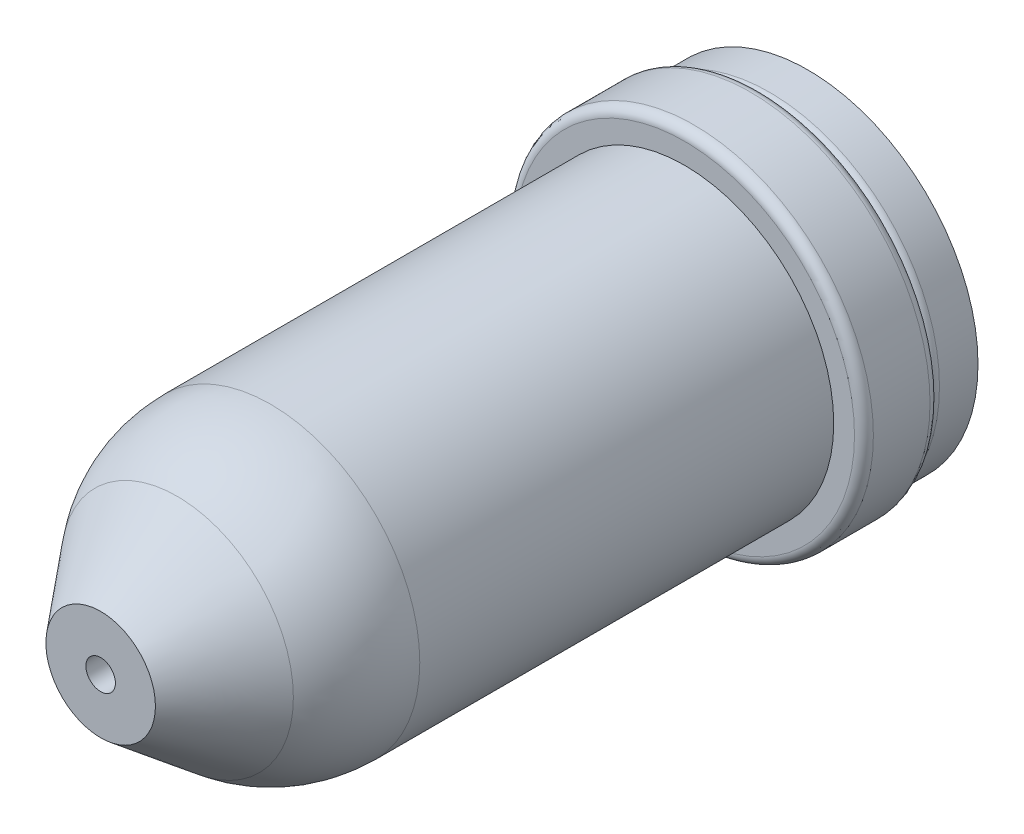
SolidWorks part; units mm, degrees
ref_plane "Front Plane" through (0, 0, 0) normal (0, 0, 1) x (1, 0, 0)
ref_plane "Top Plane" through (0, 0, 0) normal (0, 1, 0) x (1, 0, 0)
ref_plane "Right Plane" through (0, 0, 0) normal (1, 0, 0) x (0, 0, -1)
other "Center of Mass" [suppressed]
sketch "Sketch1" plane through (0, 0, 0) normal (0, 1, 0) x (1, 0, 0)
  line L0 (0, 0) -> (0, 254)
  line L1 (0, 254) -> (63.5, 254)
  line L2 (63.5, 254) -> (63.5, 244.221)
  line L3 (63.5, 244.221) -> (57.15, 237.871)
  line L4 (57.15, 237.871) -> (57.15, 224.917)
  line L5 (53.975, 221.742) -> (50.165, 221.742)
  line L6 (50.165, 221.742) -> (50.165, 57.15)
  line L7 (39.0926, 25.7128) -> (18.415, 0)
  line L8 (18.415, 0) -> (0, 0)
  line L9 (57.15, 237.871) -> (57.15, 244.221) construction
  line L10 (57.15, 244.221) -> (63.5, 244.221) construction
  arc A0 (57.15, 224.917) -> (53.975, 221.742) centre (53.975, 224.917) cw
  arc A1 (39.0926, 25.7128) -> (50.165, 57.15) centre (0, 57.15) ccw
  dimension "D4" = 3.175
  dimension "D1" = 254
  dimension "D2" = 32.258
  dimension "D3" = 63.5
  dimension "D5" = 45
  dimension "D6" = 16.129
  dimension "D7" = 6.35
  dimension "D8" = 50.165
  dimension "D9" = 18.415
  dimension "D10" = 57.15
revolve "Revolve1" add sketch "Sketch1" angle 360 about L0
sketch "Sketch2" plane through (0, 0, 0) normal (0, 1, 0) x (1, 0, 0)
  line L0 (0, 0) -> (0, 254) construction
  line L1 (63.5, 254) -> (-63.5, 254) construction
  line L2 (50.165, 57.15) -> (50.165, 221.742) construction
  line L3 (60.325, 218.567) -> (60.325, 199.517)
  line L4 (57.15, 221.742) -> (50.165, 221.742)
  line L5 (50.165, 221.742) -> (50.165, 196.342)
  line L6 (50.165, 196.342) -> (57.15, 196.342)
  line L7 (-50.165, 221.742) -> (50.165, 221.742) construction
  line L8 (-53.975, 221.742) -> (53.975, 221.742) construction
  line L9 (50.165, 209.042) -> (0, 209.042) construction
  arc A0 (57.15, 196.342) -> (60.325, 199.517) centre (57.15, 199.517) ccw
  arc A1 (60.325, 218.567) -> (57.15, 221.742) centre (57.15, 218.567) ccw
  point P19 (60.325, 196.342)
  point P22 (60.325, 221.742)
  dimension "D4" = 3.175
  dimension "D1" = 10.16
  dimension "D2" = 50.165
  dimension "D3" = 25.4
revolve "Revolve2" add sketch "Sketch2" angle 360 about L0
ref_plane "Plane1" through (0, 0, -237.871) normal (0, 0, 1) x (1, 0, 0)
sketch "Sketch3" plane through (0, 0, -254) normal (0, 0, -1) x (-1, 0, 0)
  line L0 (0, 29.21) -> (0, 0) construction
  line L1 (0, 0) -> (-25.2966, -14.605) construction
  line L2 (0, 0) -> (25.2966, -14.605) construction
  line L3 (-25.2966, -14.605) -> (-52.7929, -30.48) construction
  line L4 (25.2966, -14.605) -> (52.7929, -30.48) construction
  line L5 (0, 29.21) -> (0, 60.96) construction
  line L6 (-52.7929, -30.48) -> (-54.9926, -31.75) construction
  line L7 (52.7929, -30.48) -> (54.9926, -31.75) construction
  line L8 (0, 60.96) -> (0, 63.5) construction
  line L9 (-29.2648, 16.896) -> (0, 0) construction
  line L10 (0, 0) -> (29.2648, 16.896) construction
  line L11 (0, 0) -> (0, -33.7921) construction
  arc A0 (-31.13, 22.9659) -> (-35.4541, 15.4764) centre (-29.2648, 16.896) ccw
  arc A1 (35.4541, 15.4764) -> (31.13, 22.9659) centre (29.2648, 16.896) ccw
  arc A2 (4.3241, -38.4423) -> (35.4541, 15.4764) centre (25.2966, -14.605) ccw
  circle A3 centre (0, 0) radius 63.5 construction
  arc A4 (-35.4541, 15.4764) -> (-4.3241, -38.4423) centre (-25.2966, -14.605) ccw
  arc A5 (-4.3241, -38.4423) -> (4.3241, -38.4423) centre (0, -33.7921) ccw
  arc A6 (31.13, 22.9659) -> (-31.13, 22.9659) centre (0, 29.21) ccw
  point P8 (0, 63.5)
  point P12 (-54.9926, -31.75)
  dimension "D6" = 31.75
  dimension "D7" = 31.75
  dimension "D8" = 31.75
  dimension "D9" = 12.7
  dimension "D1" = 120
  dimension "D2" = 120
  dimension "D3" = 2.54
  dimension "D4" = 2.54
  dimension "D5" = 2.54
  dimension "D10" = 60
  dimension "D11" = 60
  dimension "D12" = 33.7921
  dimension "D13" = 33.7921
  dimension "D14" = 33.7921
sketch "Sketch5" plane through (0, 0, -237.871) normal (0, 0, 1) x (1, 0, 0)
  line L1 (29.2648, 16.896) -> (0, 0) construction
  line L2 (0, 0) -> (-29.2648, 16.896) construction
  line L3 (0, 0) -> (0, -33.7921) construction
  line L5 (-27.8558, 8.7502) -> (-21.5058, 19.7487) construction
  line L6 (21.5058, 19.7487) -> (27.8558, 8.7502) construction
  line L7 (29.2648, 16.896) -> (0, 0) construction
  line L8 (0, 0) -> (-29.2648, 16.896) construction
  line L9 (0, 0) -> (0, -33.7921) construction
  arc A0 (27.8558, 8.7502) -> (21.5058, 19.7487) centre (18.2663, 10.546) ccw
  arc A3 (-21.5058, 19.7487) -> (-27.8558, 8.7502) centre (-18.2663, 10.546) ccw
  arc A4 (-6.35, -28.4989) -> (6.35, -28.4989) centre (0, -21.0921) ccw
  arc A7 (6.35, -28.4989) -> (27.8558, 8.7502) centre (25.2966, -14.605) ccw
  arc A9 (-27.8558, 8.7502) -> (-6.35, -28.4989) centre (-25.2966, -14.605) ccw
  arc A11 (21.5058, 19.7487) -> (-21.5058, 19.7487) centre (0, 29.21) ccw
  dimension "D1" = 23.495
  dimension "D2" = 23.495
  dimension "D3" = 23.495
  dimension "D4" = 12.7
  dimension "D5" = 12.7
  dimension "D6" = 12.7
  dimension "D7" = 12.7
loft "Cut-Loft2" cut profiles "Sketch3", "Sketch5"
sketch "Sketch6" plane through (0, 0, -254) normal (0, 0, -1) x (-1, 0, 0)
  line L0 (-32.4398, 11.3968) -> (-6.35, -3.6662)
  line L1 (-6.35, -3.6662) -> (-6.35, -33.7921)
  line L2 (6.35, -33.7921) -> (6.35, -3.6662)
  line L3 (6.35, -3.6662) -> (32.4398, 11.3968)
  line L4 (26.0898, 22.3953) -> (0, 7.3323)
  line L5 (0, 7.3323) -> (-26.0898, 22.3953)
  arc A0 (-6.35, -33.7921) -> (6.35, -33.7921) centre (0, -33.7921) ccw
  arc A1 (32.4398, 11.3968) -> (26.0898, 22.3953) centre (29.2648, 16.896) ccw
  arc A2 (-26.0898, 22.3953) -> (-32.4398, 11.3968) centre (-29.2648, 16.896) ccw
  arc A7 (35.4541, 15.4764) -> (31.13, 22.9659) centre (29.2648, 16.896) ccw construction
  arc A8 (-31.13, 22.9659) -> (-35.4541, 15.4764) centre (-29.2648, 16.896) ccw construction
  arc A9 (-4.3241, -38.4423) -> (4.3241, -38.4423) centre (0, -33.7921) ccw construction
extrude "Cut-Extrude1" cut sketch "Sketch6" against normal up to surface (16.129 mm away) contours L0 L1 A0 L2 L3 A1 L4 L5 A2
sketch "Sketch17" plane through (0, 0, 0) normal (0, 1, 0) x (1, 0, 0)
  line L0 (-57.15, 237.871) -> (-63.5, 244.221)
  line L1 (-63.5, 244.221) -> (-63.5, 254)
  line L2 (-63.5, 254) -> (0, 254)
  line L3 (63.5, 254) -> (-63.5, 254) construction
  line L4 (0, 254) -> (0, 237.871)
  line L5 (57.15, 237.871) -> (-57.15, 237.871) construction
  line L6 (0, 237.871) -> (-57.15, 237.871)
sketch "Sketch8" plane through (0, 0, 0) normal (0, 0, 1) x (1, 0, 0)
  point P0 (0, 0)
hole_wizard "7/16-20 Tapped Hole1" positions "Sketch10" profile "Sketch9" tap size "7/16-20" standard "ANSI Inch"
sketch "Sketch10" plane through (0, 0, 0) normal (0, 0, 1) x (1, 0, 0)
  point P0 (0, 0)
sketch "Sketch9" plane through (0, 0, 0) normal (1, 0, 0) x (0, -1, 0)
  line L0 (0, 0) -> (0, 31.5556)
  line L1 (0, 31.5556) -> (4.9606, 28.575)
  line L2 (4.9606, 28.575) -> (4.9606, 0)
  line L5 (4.9606, 0) -> (0, 0)
  line L10 (0, 31.5556) -> (-4.9606, 28.575) construction
  line L11 (0, -6.35) -> (0, 107.95) construction
  dimension "Tap Drill Dia." = 9.9212
  dimension "Tap Drill Depth" = 28.575
  dimension "Drill Angle" = 118
sketch "Sketch11" plane through (0, 0, -237.871) normal (0, 0, -1) x (-1, 0, 0)
  point P0 (-29.2648, 16.896)
  point P1 (29.2648, 16.896)
  point P3 (0, -33.7921)
hole_wizard "1/4-20 Tapped Hole1" positions "Sketch13" profile "Sketch12" tap size "1/4-20" standard "ANSI Inch"
sketch "Sketch13" plane through (0, 0, -237.871) normal (0, 0, -1) x (-1, 0, 0)
  point P0 (-29.2648, 16.896)
  point P3 (29.2648, 16.896)
  point P6 (0, -33.7921)
sketch "Sketch12" plane through (29.2648, 16.896, -237.871) normal (1, 0, 0) x (0, 1, 0)
  line L0 (0, 0) -> (0, 20.5838)
  line L1 (0, 20.5838) -> (2.5527, 19.05)
  line L2 (2.5527, 19.05) -> (2.5527, 0)
  line L5 (2.5527, 0) -> (0, 0)
  line L10 (0, 20.5838) -> (-2.5527, 19.05) construction
  line L11 (0, -6.35) -> (0, 107.95) construction
  dimension "Tap Drill Dia." = 5.1054
  dimension "Tap Drill Depth" = 19.05
  dimension "Drill Angle" = 118
revolve "Cut-Revolve3" cut sketch "Sketch17" angle 360 about L4
sketch "Sketch7" plane through (0, 0, -237.871) normal (0, 0, -1) x (-1, 0, 0)
  line L0 (25.2966, -14.605) -> (-25.2966, -14.605) construction
  line L1 (-25.2966, -14.605) -> (0, 29.21) construction
  line L2 (0, 29.21) -> (25.2966, -14.605) construction
  line L3 (0, 0) -> (0, -14.605) construction
  circle A0 centre (-25.2966, -14.605) radius 22.225
  circle A1 centre (25.2966, -14.605) radius 22.225
  circle A2 centre (0, 29.21) radius 22.225
  dimension "D1" = 14.605
  dimension "D2" = 44.45
  dimension "D3" = 60
  dimension "D4" = 50.5932
extrude "Boss-Extrude1" add sketch "Sketch7" along normal blind 3.175
fillet "Fillet1" radius 0.635 3 edges at (-22.225, 29.21, -241.046) (-47.5216, -14.605, -241.046) (3.0716, -14.605, -241.046)
